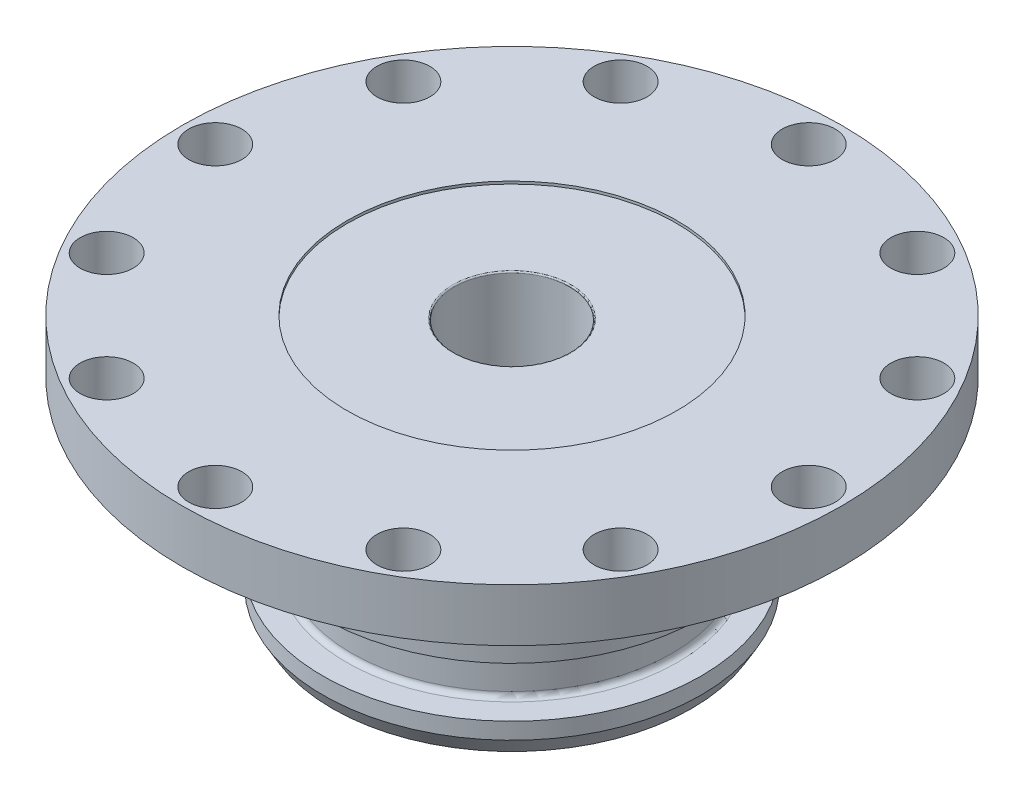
SolidWorks part; units mm, degrees
ref_plane "Front" through (0, 0, 0) normal (0, 0, 1) x (1, 0, 0)
ref_plane "Top" through (0, 0, 0) normal (0, 1, 0) x (1, 0, 0)
ref_plane "Right" through (0, 0, 0) normal (1, 0, 0) x (0, 0, -1)
sketch "Sketch1" plane through (0, 0, 0) normal (0, 0, 1) x (1, 0, 0)
  line L0 (0, 0) -> (0, -20411.5893) construction
  line L1 (0, 0) -> (18.2118, 0)
  line L2 (18.2118, 0) -> (18.2118, 3.175)
  line L3 (18.2118, 3.175) -> (15.4305, 3.175)
  line L4 (15.4305, 3.175) -> (15.4305, 8.001)
  line L5 (15.4305, 8.001) -> (18.2118, 8.001)
  line L6 (18.2118, 8.001) -> (18.2118, 11.176)
  line L7 (18.2118, 11.176) -> (15.4305, 11.176)
  line L8 (15.4305, 11.176) -> (15.4305, 16.002)
  line L9 (15.4305, 16.002) -> (18.2118, 16.002)
  line L10 (18.2118, 16.002) -> (18.2118, 18.2563)
  line L11 (19.0055, 19.05) -> (31.75, 19.05)
  line L12 (31.75, 19.05) -> (31.75, 24.13)
  line L13 (31.75, 24.13) -> (0, 24.13)
  line L14 (10.4775, 0) -> (10.4775, 24.13) construction
  line L15 (0, 24.13) -> (0, 0)
  line L16 (10.4775, 12.065) -> (-10.4775, 12.065) construction
  line L17 (18.2499, 0) -> (18.2499, 13.1254) construction
  line L18 (18.2499, 13.1254) -> (19.8374, 19.05) construction
  arc A0 (18.2118, 18.2563) -> (19.0055, 19.05) centre (19.0055, 18.2563) cw
  circle A1 centre (17.1958, 14.2367) radius 1.7653 construction
  point P23 (0, 12.065)
  point P31 (25.3778, 19.05)
  dimension "D13" = 0.7937
  dimension "D17" = 3.5306
  dimension "D19" = 0.8763
  dimension "D1" = 63.5
  dimension "D2" = 19.05
  dimension "D3" = 20.955
  dimension "D4" = 4.826
  dimension "D5" = 36.4236
  dimension "D6" = 0.0381
  dimension "D7" = 15
  dimension "D8" = 30.861
  dimension "D9" = 2.7813
  dimension "D10" = 18.2499
  dimension "D11" = 50.7555
  dimension "D12" = 24.13
  dimension "D14" = 3.175
  dimension "D15" = 3.175
  dimension "D16" = 1.5875
  dimension "D18" = 15.875
revolve "Revolve1" add sketch "Sketch1" angle 360 about L0
hole_wizard "#10 Clearance Hole1" positions "Sketch3" profile "Sketch4" hole size "#10" standard "ANSI Inch"
sketch "Sketch3" plane through (0, 24.13, 0) normal (0, 1, 0) x (1, 0, 0)
  line L0 (0, 0) -> (0, 28.575) construction
  line L4 (24.7467, -14.2875) -> (0, 28.575) construction
  line L5 (0, 28.575) -> (-24.7467, -14.2875) construction
  line L6 (-24.7467, -14.2875) -> (24.7467, -14.2875) construction
  line L8 (-31.1073, 50.8282) -> (0.5898, -59.5888)
  line L9 (-31.1073, 50.8282) -> (-0.5898, 59.5888)
  line L10 (0.5898, -59.5888) -> (31.1073, -50.8282)
  line L11 (-0.5898, 59.5888) -> (31.1073, -50.8282)
  line L12 (15.8486, -55.2085) -> (-15.8486, 55.2085) construction
  line L13 (-15.2587, -4.3803) -> (15.2587, 4.3803) construction
  circle A0 centre (0, 0) radius 28.575
  circle A1 centre (0, 0) radius 31.75 construction
  circle A2 centre (24.7467, -14.2875) radius 3.9688
  circle A3 centre (-24.7467, -14.2875) radius 3.9688
  circle A4 centre (-14.2875, -24.7467) radius 3.9688
  point P0 (0, 28.575)
  point P7 (14.2875, 24.7467)
  point P8 (24.7467, 14.2875)
  point P9 (28.575, 0)
  point P10 (24.7467, -14.2875)
  point P11 (14.2875, -24.7467)
  point P12 (0, -28.575)
  point P13 (-14.2875, -24.7467)
  point P23 (-24.7467, -14.2875)
  point P24 (-28.575, 0)
  point P25 (-24.7467, 14.2875)
  point P26 (-14.2875, 24.7467)
  dimension "D2" = 3.175
  dimension "D3" = 7.9375
  dimension "D4" = 41.5559
  dimension "D6" = 57.15
  dimension "D5" = 31.75
  dimension "D1" = 12
sketch "Sketch4" plane through (0, 24.13, -28.575) normal (1, 0, 0) x (0, 0, 1)
  line L0 (0, 0) -> (0, 24.13)
  line L1 (0, 24.13) -> (2.5527, 24.13)
  line L2 (2.5527, 24.13) -> (2.5527, 0)
  line L5 (2.5527, 0) -> (0, 0)
  line L11 (0, -6.35) -> (0, 107.95) construction
  dimension "Thru Hole Dia." = 5.1054
  dimension "Thru Hole Depth" = 24.13
sketch "Sketch5" plane through (0, 24.13, 0) normal (0, 1, 0) x (1, 0, 0)
  circle A0 centre (0, 0) radius 15.875
  dimension "D1" = 31.75
extrude "Cut-Extrude2" cut sketch "Sketch5" against normal blind 0.254
fillet "Fillet1" radius 0.508 4 edges at (-15.4305, 3.175, 0) (-15.4305, 8.001, 0) (-15.4305, 11.176, 0) (-15.4305, 16.002, 0)
chamfer "Chamfer1" distance 1.5875 angle 30 1 edges at (-18.2118, 0, 0)
hole_wizard "3/4-20 Tapped Hole1" positions "Sketch6" profile "Sketch7" tap size "3/4-20" standard "ANSI Inch"
sketch "Sketch6" plane through (0, 24.13, 0) normal (0, 1, 0) x (1, 0, 0)
  point P0 (0, 0)
sketch "Sketch7" plane through (0, 24.13, 0) normal (1, 0, 0) x (0, 0, 1)
  line L0 (0, 0) -> (0, 24.13)
  line L1 (0, 24.13) -> (9.525, 24.13)
  line L2 (9.525, 24.13) -> (9.525, 0)
  line L5 (9.525, 0) -> (0, 0)
  line L11 (0, -6.35) -> (0, 107.95) construction
  dimension "Thread Major Dia." = 19.05
  dimension "Thru Tap Drill Depth" = 24.13
hole_wizard "7/16-20 Tapped Hole1" positions "Sketch8" profile "Sketch9" tap size "7/16-20" standard "ANSI Inch"
sketch "Sketch8" plane through (0, 24.13, 0) normal (0, 1, 0) x (1, 0, 0)
  point P0 (0, 0)
sketch "Sketch9" plane through (0, 24.13, 0) normal (1, 0, 0) x (0, 0, 1)
  line L0 (0, 0) -> (0, 24.13)
  line L1 (0, 24.13) -> (5.5562, 24.13)
  line L2 (5.5562, 24.13) -> (5.5562, 0)
  line L5 (5.5562, 0) -> (0, 0)
  line L11 (0, -6.35) -> (0, 107.95) construction
  dimension "Thread Major Dia." = 11.1125
  dimension "Thru Tap Drill Depth" = 24.13
fillet "Fillet2" radius 0.127 1 edges at (-5.5562, 23.876, 0)
sketch "Sketch12" [suppressed] plane through (-33.8994, 23.876, 53.8696) normal (0, -1, 0) x (1, 0, 0)
  line L0 (33.8994, -50.6946) -> (33.8994, -57.0446) construction
  line L1 (37.0744, -53.8696) -> (30.7244, -53.8696) construction
  circle A0 centre (33.8994, -53.8696) radius 15.875 construction
  point P5 (33.8994, -53.8696)
  dimension "D3" = 6.35
ref_plane "Plane1" [suppressed] through (0, 23.876, 0) normal (0, 0, -1) x (-0.7994, -0.6007, 0)
sketch "Sketch14" [suppressed] plane through (1.3436, 23.876, 0) normal (0, 0, 1) x (-1, 0, 0)
  line L0 (1.3436, 0) -> (1.3436, 45.0293) construction
  line L1 (1.3436, 54.3077) -> (4.5186, 52.4)
  line L2 (4.5186, 52.4) -> (4.5186, 13.1)
  line L3 (4.5186, 13.1) -> (6.8998, 13.1)
  line L4 (6.8998, 13.1) -> (6.8998, 4.1104)
  line L5 (6.8998, 4.1104) -> (6.8103, 4.2)
  line L6 (6.8103, 4.2) -> (7.3201, 1.8012)
  line L7 (7.5686, 1.6) -> (11.8436, 1.6)
  line L8 (11.8436, 1.6) -> (11.8436, 0)
  line L10 (11.8436, 0) -> (1.3436, 0)
  line L11 (1.3436, 0) -> (1.3436, 54.3077)
  line L12 (-4.1231, 4.2) -> (-4.633, 1.8012) construction
  line L13 (-4.2127, 4.1104) -> (-4.1231, 4.2) construction
  line L14 (1.3436, 54.3077) -> (-1.8314, 52.4) construction
  arc A0 (7.3201, 1.8012) -> (7.5686, 1.6) centre (7.5686, 1.854) ccw
  dimension "D1" = 0.254
  dimension "Countersink angle" = 118
  dimension "D3" = 45
  dimension "TapDrillDia" = 6.35
  dimension "D5" = 12.45
  dimension "ThdMjr" = 11.1125
  dimension "SpotDia" = 21
  dimension "L3" = 1.6
  dimension "L1" = 2.6
  dimension "ThdDp" = 11.5
  dimension "TapDrillDp" = 50.8
  dimension "K" = 12
revolve "Cut-Revolve1" [suppressed] cut sketch "Sketch14" angle 360 about L0
other "sae j1926-1 (circular face)<1>" [suppressed]
sketch "Sketch10" plane through (0, 24.13, 0) normal (0, 1, 0) x (1, 0, 0)
  line L1 (10.3098, 24.89) -> (-10.3098, 24.89)
  line L2 (-10.3098, 24.89) -> (-24.89, 10.3098)
  line L3 (-24.89, 10.3098) -> (-24.89, -10.3098)
  line L4 (-24.89, -10.3098) -> (-10.3098, -24.89)
  line L5 (-10.3098, -24.89) -> (10.3098, -24.89)
  line L6 (10.3098, -24.89) -> (24.89, -10.3098)
  line L7 (24.89, -10.3098) -> (24.89, 10.3098)
  line L8 (24.89, 10.3098) -> (10.3098, 24.89)
  circle A1 centre (0, 0) radius 26.9408 construction
  dimension "D1" = 38.1
sketch "Sketch11" plane through (0, 24.13, 0) normal (0, 1, 0) x (1, 0, 0)
  line L1 (19.8374, 19.8374) -> (0, 28.0543)
  line L2 (0, 28.0543) -> (-19.8374, 19.8374)
  line L3 (-19.8374, 19.8374) -> (-28.0543, 0)
  line L4 (-28.0543, 0) -> (-19.8374, -19.8374)
  line L5 (-19.8374, -19.8374) -> (0, -28.0543)
  line L6 (0, -28.0543) -> (19.8374, -19.8374)
  line L7 (19.8374, -19.8374) -> (28.0543, 0)
  line L8 (28.0543, 0) -> (19.8374, 19.8374)
  line L13 (-19.8374, 19.8374) -> (19.8374, 19.8374)
  line L14 (-19.8374, 19.8374) -> (-19.8374, -19.8374)
  line L15 (-19.8374, -19.8374) -> (19.8374, -19.8374)
  line L16 (19.8374, 19.8374) -> (19.8374, -19.8374)
  circle A0 centre (0, 0) radius 28.0543 construction
  circle A1 centre (-19.8374, -19.8374) radius 3.9624
  circle A2 centre (19.8374, -19.8374) radius 3.9624
  circle A3 centre (0, 0) radius 32.0167
  dimension "D1" = 7.9248
  dimension "D2" = 7.9248
  dimension "D3" = 31.75
  dimension "D4" = 64.0334
